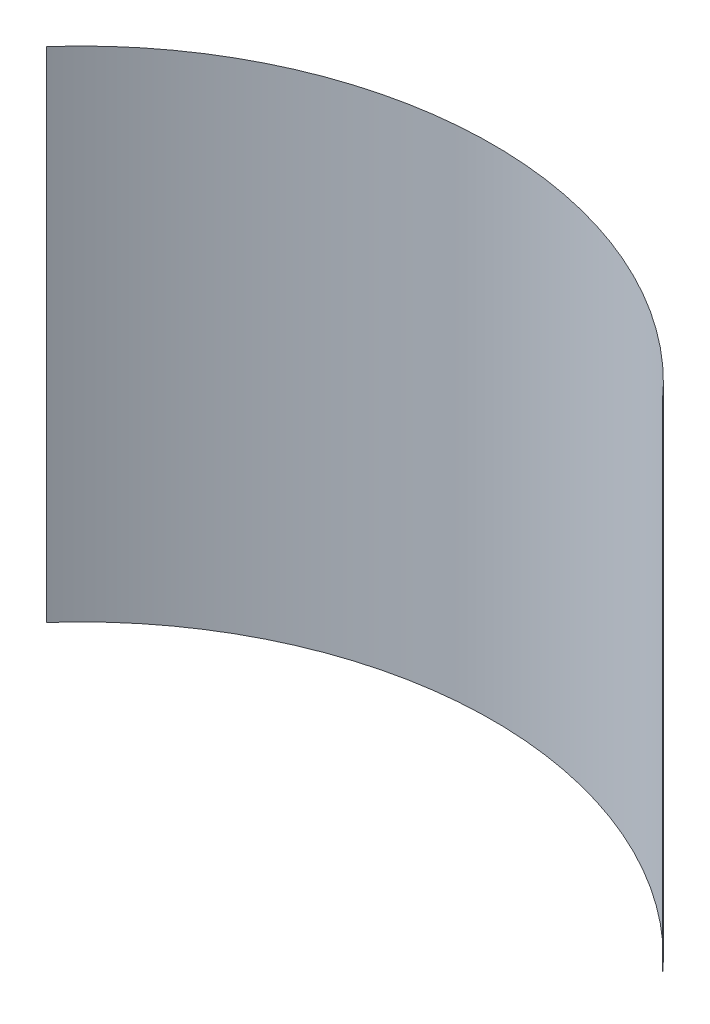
SolidWorks part; units mm, degrees
ref_plane "Front Plane" through (0, 0, 0) normal (0, 0, 1) x (1, 0, 0)
ref_plane "Top Plane" through (0, 0, 0) normal (0, 1, 0) x (1, 0, 0)
ref_plane "Right Plane" through (0, 0, 0) normal (1, 0, 0) x (0, 0, -1)
sketch "Sketch1" plane through (0, 0, 0) normal (0, 1, 0) x (1, 0, 0)
  arc A0 (-68.7809, 31.183) -> (72.3446, 31.183) centre (1.7819, -31.4734) cw
surface "Surface-Extrude1" sketch "Sketch1" parameters "D1"=114.3
sketch "Sketch2" plane through (0, 0, 0) normal (0, 0, 1) x (1, 0, 0)
  circle A0 centre (0, 60.353) radius 25.4563
curve "Curve1"
